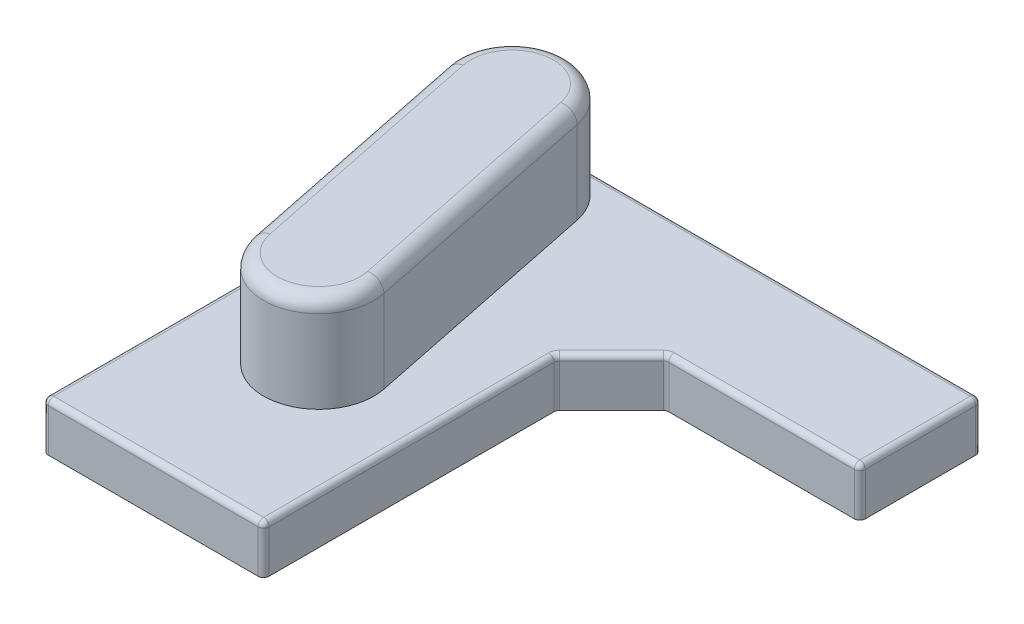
SolidWorks part; units mm, degrees
other "DetailItem1"
other "Aluflex AB"
ref_plane "Front Plane" through (0, 0, 0) normal (0, 0, 1) x (1, 0, 0)
ref_plane "Top Plane" through (0, 0, 0) normal (0, 1, 0) x (1, 0, 0)
ref_plane "Right Plane" through (0, 0, 0) normal (1, 0, 0) x (0, 0, -1)
sketch "Sketch1" plane through (0, 0, 0) normal (0, 1, 0) x (1, 0, 0)
  line L0 (0, 0) -> (0, 170)
  line L1 (0, 170) -> (170, 170)
  line L2 (170, 170) -> (170, 126)
  line L3 (170, 126) -> (99.98, 126)
  line L4 (80, 106.02) -> (80, 0)
  line L5 (80, 0) -> (0, 0)
  line L6 (80, 106.02) -> (99.98, 126)
  dimension "D1" = 170
  dimension "D2" = 44
  dimension "D3" = 135
  dimension "D4" = 170
  dimension "D5" = 80
extrude "Boss-Extrude1" add sketch "Sketch1" along normal blind 17.5
fillet "Fillet1" radius 22 1 edges at (0, 8.75, -170)
fillet "Fillet2" radius 2 6 edges at (170, 8.75, -170) (170, 8.75, -126) (80, 8.75, -106.02) (99.98, 8.75, -126) (80, 8.75, 0) (0, 8.75, 0)
fillet "Fillet3" radius 2 14 edges at (169.4142, 17.5, -126.5858) (134.4042, 17.5, -126) (100.0431, 17.5, -125.8478) (89.99, 17.5, -116.01) (80.1522, 17.5, -105.9569) (80, 17.5, -53.5958) (79.4142, 17.5, -0.5858) (40, 17.5, 0) (0.5858, 17.5, -0.5858) (0, 17.5, -75) (6.4437, 17.5, -163.5563) (95, 17.5, -170) (169.4142, 17.5, -169.4142) (170, 17.5, -148)
fillet "Fillet4" [suppressed] radius 22
fillet "Fillet5" [suppressed] radius 2
fillet "Fillet6" [suppressed] radius 2
sketch "Sketch2" plane through (0, 0, 0) normal (0, -1, 0) x (1, 0, 0)
  line L0 (2, 0) -> (78, 0) construction
  line L1 (0, -148) -> (0, -2) construction
  circle A0 centre (40, -60) radius 19
  dimension "D3" = 38
  dimension "D1" = 60
  dimension "D2" = 40
extrude "Cut-Extrude1" cut sketch "Sketch2" against normal blind 1
sketch "Sketch3" [suppressed] plane through (0, 17.5, 0) normal (0, 1, 0) x (1, 0, 0)
  line L0 (2, 0) -> (78, 0) construction
  line L1 (80, 2) -> (80, 105.1915) construction
  circle A0 centre (40, 60) radius 19
  dimension "D3" = 38
  dimension "D1" = 60
  dimension "D2" = 40
extrude "Cut-Extrude2" [suppressed] cut sketch "Sketch3" against normal blind 1
sketch "Sketch4" [suppressed] plane through (0, 0, 0) normal (0, -1, 0) x (1, 0, 0)
  line L0 (40, -60) -> (22, -148) construction
  line L1 (59.5943, -64.0079) -> (41.5943, -152.0079)
  line L2 (20.4057, -55.9921) -> (2.4057, -143.9921)
  arc A0 (59.5943, -64.0079) -> (20.4057, -55.9921) centre (40, -60) ccw
  arc A1 (2.4057, -143.9921) -> (41.5943, -152.0079) centre (22, -148) ccw
  point P2 (31, -104)
  dimension "D1" = 20
extrude "Boss-Extrude2" [suppressed] add sketch "Sketch4" along normal blind 35
fillet "Fillet7" [suppressed] radius 5
sketch "Sketch5" plane through (0, 17.5, 0) normal (0, 1, 0) x (1, 0, 0)
  line L0 (22, 148) -> (40, 60) construction
  line L1 (41.5943, 152.0079) -> (59.5943, 64.0079)
  line L2 (2.4057, 143.9921) -> (20.4057, 55.9921)
  arc A0 (41.5943, 152.0079) -> (2.4057, 143.9921) centre (22, 148) ccw
  arc A1 (20.4057, 55.9921) -> (59.5943, 64.0079) centre (40, 60) ccw
  point P4 (31, 104)
  dimension "D1" = 20
extrude "Boss-Extrude3" add sketch "Sketch5" along normal blind 35
fillet "Fillet8" radius 5 4 edges at (50.5943, 52.5, -108.0079) (44.0079, 52.5, -40.4057) (11.4057, 52.5, -99.9921) (17.9921, 52.5, -167.5943)
